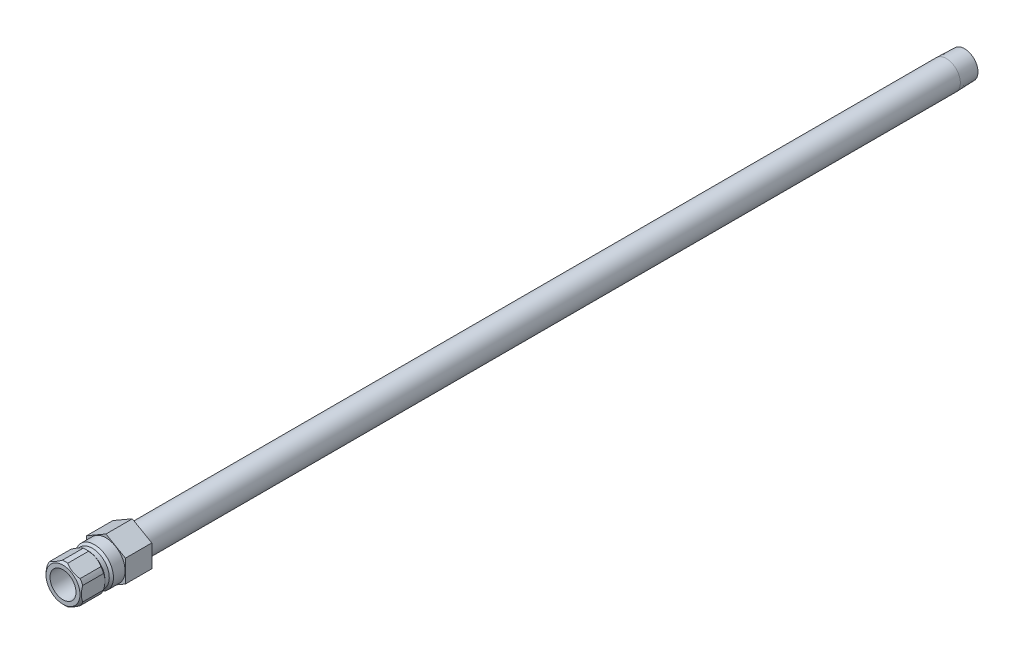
SolidWorks part; units mm, degrees
ref_plane "Front Plane" through (0, 0, 0) normal (0, 0, 1) x (1, 0, 0)
ref_plane "Top Plane" through (0, 0, 0) normal (0, 1, 0) x (1, 0, 0)
ref_plane "Right Plane" through (0, 0, 0) normal (1, 0, 0) x (0, 0, -1)
sketch "Sketch1" plane through (0, 0, 0) normal (1, 0, 0) x (0, 0, -1)
  line L0 (9.652, 0) -> (-18.923, 0) construction
  line L1 (-15.748, 4.7625) -> (-15.748, 6.223)
  line L2 (-6.604, 6.223) -> (-6.604, 0) construction
  line L3 (-14.986, 6.985) -> (-7.366, 6.985)
  line L4 (9.652, 5.1435) -> (9.652, 0) construction
  line L5 (-6.604, 6.223) -> (-5.0165, 6.223)
  line L6 (-4.2545, 6.985) -> (9.652, 6.985)
  line L7 (9.652, 6.985) -> (9.652, 5.1435)
  line L8 (-6.604, 6.223) -> (-7.366, 6.985)
  line L9 (-5.0165, 6.223) -> (-4.2545, 6.985)
  line L10 (-15.748, 6.223) -> (-14.986, 6.985)
  line L11 (-15.748, 4.7625) -> (-3.556, 4.7625)
  line L12 (9.652, 5.1435) -> (307.7718, 5.1435)
  line L13 (307.7718, 5.1435) -> (314.452, 4.9347)
  line L14 (314.452, 4.9347) -> (314.452, 3.4163)
  line L15 (-3.556, 4.7625) -> (-3.556, 6.985) construction
  line L16 (9.652, 6.731) -> (9.652, 0) construction
  line L17 (-3.556, 4.7625) -> (-2.8402, 3.4163)
  line L19 (-2.8402, 3.4163) -> (314.452, 3.4163)
  dimension "D2" = 1.5875
  dimension "D3" = 0.762
  dimension "D4" = 45
  dimension "D5" = 9.144
  dimension "D6" = 45
  dimension "D7" = 1.79
  dimension "D8" = 6.6802
  dimension "D9" = 330.2
  dimension "D10" = 3.175
  dimension "D11" = 9.525
  dimension "D12" = 10.287
  dimension "D13" = 25.4
  dimension "D14" = 13.97
  dimension "D15" = 6.8326
  dimension "D16" = 15.748
  dimension "D17" = 12.192
  dimension "D18" = 118
revolve "Revolve1" add sketch "Sketch1" angle 360 about L0
sketch "Sketch2" plane through (0, 0, 0) normal (0, 0, 1) x (1, 0, 0)
  line L1 (-7.112, 4.1061) -> (-7.112, -4.1061)
  line L2 (-7.112, -4.1061) -> (0, -8.2122)
  line L3 (0, -8.2122) -> (7.112, -4.1061)
  line L4 (7.112, -4.1061) -> (7.112, 4.1061)
  line L5 (7.112, 4.1061) -> (0, 8.2122)
  line L6 (0, 8.2122) -> (-7.112, 4.1061)
  circle A0 centre (0, 0) radius 7.112 construction
  circle A1 centre (0, 0) radius 4.7625 construction
  circle A2 centre (0, 0) radius 4.7625
  dimension "D1" = 14.224
extrude "Boss-Extrude1" add sketch "Sketch2" against normal up to vertex (9.652 mm away)
sketch "Sketch3" plane through (0, 0, 0) normal (0, 0, 1) x (1, 0, 0)
  line L1 (6.477, 3.7395) -> (0, 7.479)
  line L2 (0, 7.479) -> (-6.477, 3.7395)
  line L3 (-6.477, 3.7395) -> (-6.477, -3.7395)
  line L4 (-6.477, -3.7395) -> (0, -7.479)
  line L5 (0, -7.479) -> (6.477, -3.7395)
  line L6 (6.477, -3.7395) -> (6.477, 3.7395)
  circle A0 centre (0, 0) radius 6.477 construction
  dimension "D1" = 12.954
extrude "Cut-Extrude1" cut sketch "Sketch3" along normal through all from vertex at 6.604 flip side to cut
